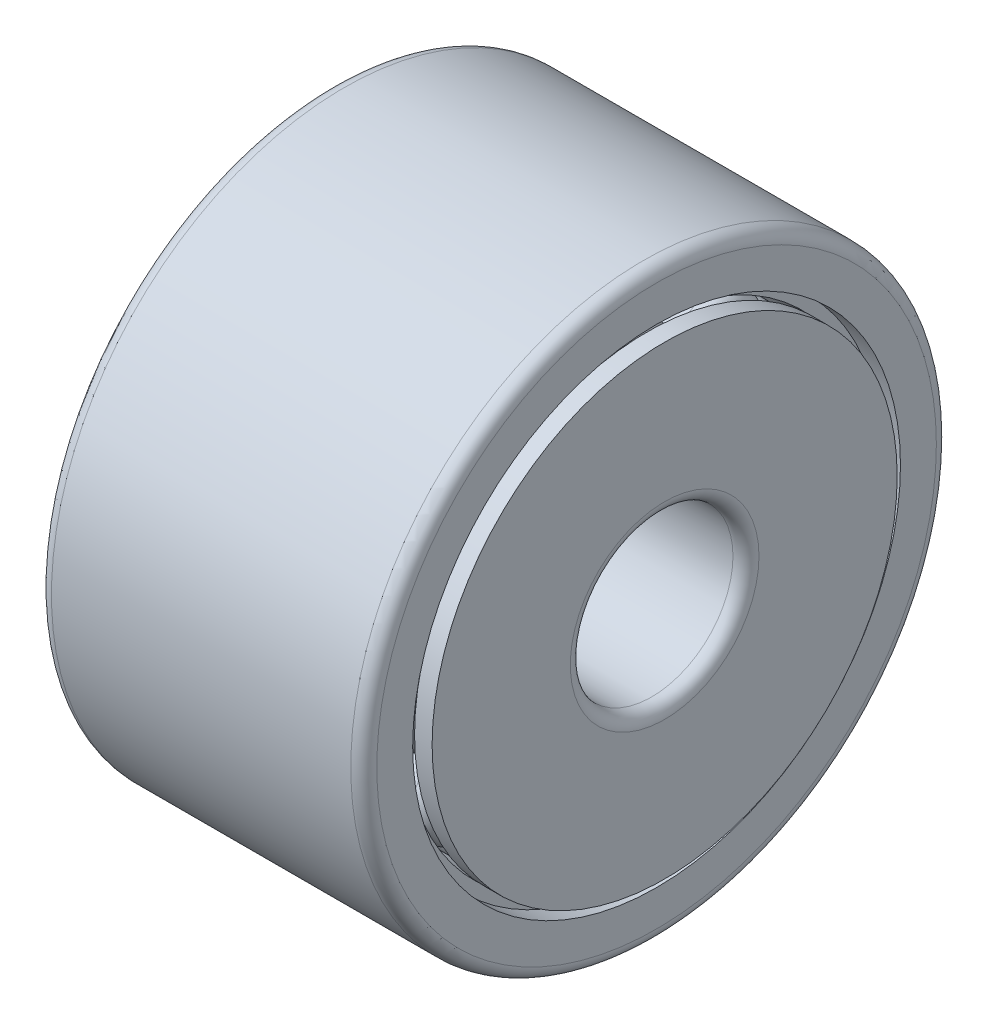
SolidWorks part; units mm, degrees
ref_plane "Plane1" through (0, 0, 0) normal (0, 0, 1) x (1, 0, 0)
ref_plane "Plane2" through (0, 0, 0) normal (0, 1, 0) x (1, 0, 0)
ref_plane "Plane3" through (0, 0, 0) normal (1, 0, 0) x (0, 0, -1)
sketch "Clipboard" plane through (0, 0, 0) normal (0, 0, 1) x (1, 0, 0)
  line L0 (-10, 0) -> (10, 0) construction
  line L1 (0, 0) -> (27.0344, -5.7463)
  line L2 (0, 0) -> (22.4793, 28.7722)
  line L3 (0, 0) -> (27.9428, -35.7651)
  line L4 (0, 0) -> (-22.3471, -0.7804)
  dimension "CLdia" = 36.5125
  dimension "Count" = 52
  dimension "Show_count" = 52
  dimension "Max_count" = 12
  dimension "Min_count" = 2
  dimension "Race_OD" = 45.3866
  dimension "Race_ID" = 27.6384
sketch "OutRacSke" plane through (0, 0, 0) normal (0, 0, 1) x (1, 0, 0)
  line L0 (-14.0229, 22.6933) -> (-14.0229, 23.8026)
  line L1 (-14.0229, 23.8026) -> (-15.875, 23.8026)
  line L2 (-15.875, 23.8026) -> (-15.875, 27.305)
  line L3 (-14.605, 28.575) -> (14.605, 28.575)
  line L4 (15.875, 27.305) -> (15.875, 23.8026)
  line L5 (15.875, 23.8026) -> (14.0229, 23.8026)
  line L6 (14.0229, 23.8026) -> (14.0229, 22.6933)
  line L7 (14.0229, 22.6933) -> (-14.0229, 22.6933)
  line L8 (-7.9375, 0) -> (7.9375, 0) construction
  arc A0 (-15.875, 27.305) -> (-14.605, 28.575) centre (-14.605, 27.305) cw
  arc A1 (14.605, 28.575) -> (15.875, 27.305) centre (14.605, 27.305) cw
  dimension "Radius" = 1.27
  dimension "D1" = 14.0229
  dimension "Race_OD" = 45.3866
  dimension "OD" = 57.15
  dimension "Cyl_Len" = 28.0458
  dimension "Width" = 31.75
  dimension "Groove_Dp" = 1.1093
  dimension "halfWidth" = 15.875
revolve "OuterRace" add sketch "OutRacSke" angle 360 about L8
sketch "RolDetSke" plane through (0, 0, 0) normal (0, 0, 1) x (1, 0, 0)
  line L0 (-14.0229, 20.9261) -> (-14.0229, 18.2562)
  line L1 (-14.0229, 18.2562) -> (14.0229, 18.2562)
  line L2 (14.0229, 18.2562) -> (14.0229, 20.9261)
  line L3 (12.243, 22.706) -> (-12.243, 22.706)
  line L4 (-28.575, 18.2562) -> (28.575, 18.2562) construction
  arc A0 (14.0229, 20.9261) -> (12.243, 22.706) centre (12.243, 20.9261) ccw
  arc A1 (-12.243, 22.706) -> (-14.0229, 20.9261) centre (-12.243, 20.9261) ccw
  dimension "radius" = 1.7799
  dimension "CLRad" = 18.2562
  dimension "Roller_diameter" = 8.8995
  dimension "Cyl_Len" = 28.0458
  dimension "halfCylLen" = 14.0229
revolve "RollerDetailed" add sketch "RolDetSke" angle 360 about L4
ref_axis "Axis1" through (-50, 0, 0) along (1, 0, 0)
pattern_circular "RollersDetailed" count 12 every 30 about axis through (-50, 0, 0) along (1, 0, 0) of "RollerDetailed"
sketch "RolSimSke" plane through (0, 25.4, 0) normal (0, 0, 1) x (1, 0, 0)
  line L0 (-14.0229, -4.4612) -> (-14.0229, -9.8009)
  line L1 (-25.4, -25.4) -> (25.4, -25.4) construction
  line L2 (14.0229, -9.8009) -> (14.0229, -4.4612)
  line L3 (12.243, -2.6813) -> (-12.243, -2.6813)
  line L5 (12.243, -11.5808) -> (-12.243, -11.5808)
  arc A0 (14.0229, -4.4612) -> (12.243, -2.6813) centre (12.243, -4.4612) ccw
  arc A1 (-12.243, -2.6813) -> (-14.0229, -4.4612) centre (-12.243, -4.4612) ccw
  arc A2 (14.0229, -9.8009) -> (12.243, -11.5808) centre (12.243, -9.8009) cw
  arc A3 (-12.243, -11.5808) -> (-14.0229, -9.8009) centre (-12.243, -9.8009) cw
  dimension "radius" = 1.7799
  dimension "Bore" = 27.6384
  dimension "Roller_diameter" = 8.8995
  dimension "Cyl_Len" = 28.0458
  dimension "halfLength" = 14.0229
revolve "RollersSimplified" [suppressed] add sketch "RolSimSke" angle 360 about L1
sketch "InsRacSke" plane through (0, 0, 0) normal (0, 0, 1) x (1, 0, 0)
  line L0 (-14.949, 13.8192) -> (-14.949, 22.6933)
  line L1 (-14.949, 22.6933) -> (-16.6624, 22.6933)
  line L2 (-16.6624, 22.6933) -> (-16.6624, 9.2075)
  line L3 (-15.3924, 7.9375) -> (-0.84, 7.9375)
  line L4 (0.84, 7.9375) -> (15.3924, 7.9375)
  line L5 (16.6624, 9.2075) -> (16.6624, 22.6933)
  line L6 (16.6624, 22.6933) -> (14.949, 22.6933)
  line L7 (14.949, 22.6933) -> (14.949, 13.8192)
  line L8 (14.949, 13.8192) -> (-14.949, 13.8192)
  line L9 (-7.9375, 0) -> (7.9375, 0) construction
  arc A0 (-16.6624, 9.2075) -> (-15.3924, 7.9375) centre (-15.3924, 9.2075) ccw
  arc A1 (-0.84, 7.9375) -> (0.84, 7.9375) centre (0, 6.985) cw
  arc A2 (15.3924, 7.9375) -> (16.6624, 9.2075) centre (15.3924, 9.2075) ccw
  dimension "radius" = 1.27
  dimension "Bore" = 15.875
  dimension "Width_IR" = 33.3248
  dimension "halfWidth" = 16.6624
  dimension "SlotWidth" = 29.8979
  dimension "Race_OD" = 45.3866
  dimension "Race_ID" = 27.6384
  dimension "offset" = 0.9525
  dimension "halfSlotWidth" = 14.949
revolve "InnerRace" add sketch "InsRacSke" angle 360 about L9
equation "\"halfWidth@OutRacSke\" =  \"Width@OutRacSke\" / 2"
equation "\"CLdia@Clipboard\" =  ( \"Race_OD@Clipboard\" + \"Race_ID@Clipboard\" )  / 2"
equation "\"CLRad@RolDetSke\" = ( \"Race_OD@Clipboard\" + \"Race_ID@Clipboard\" )  / 4"
equation "\"Roller_diameter@RolDetSke\" =  ( \"Race_OD@Clipboard\" -  \"Race_ID@Clipboard\" )  / 2 + .001"
equation "\"Roller_diameter@RolSimSke\" = ( \"Race_OD@Clipboard\" -  \"Race_ID@Clipboard\" )  / 2 + .001"
equation "\"radius@RolDetSke\" = \"Roller_diameter@RolDetSke\" / 5"
equation "\"radius@RolSimSke\" = \"Roller_diameter@RolSimSke\" / 5"
equation "\"Cyl_Len@OutRacSke\" = \"Cyl_Len@RolDetSke\""
equation "\"Cyl_Len@RolSimSke\" = \"Cyl_Len@RolDetSke\""
equation "\"halfCylLen@RolDetSke\" = \"Cyl_Len@RolDetSke\" / 2"
equation "\"offset@InsRacSke\" = \"radius@InsRacSke\" * 0.75"
equation "\"SlotWidth@InsRacSke\" =  ( \"Width@OutRacSke\" + \"Cyl_Len@RolDetSke\" )  / 2"
equation "\"halfSlotWidth@InsRacSke\" = \"SlotWidth@InsRacSke\" / 2"
equation "\"D1@OutRacSke\" = \"Cyl_Len@OutRacSke\" / 2"
equation "\"Max_count@Clipboard\" = int( 3.14159265 / atn(( \"Roller_diameter@RolDetSke\" / 2) / sqr( \"CLRad@RolDetSke\"  *  \"CLRad@RolDetSke\" - ( \"Roller_diameter@RolDetSke\" / 2) *  ( \"Roller_diameter@RolDetSke\" / "
equation "\"Max_count@Clipboard\" = ((sgn( \"Max_count@Clipboard\" - \"Count@Clipboard\" )-1)*( \"Max_count@Clipboard\" - \"Count@Clipboard\" ))/-2+ \"Count@Clipboard\""
equation "\"Count@RollersDetailed\" = int( \"Show_count@Clipboard\" ) "
equation "\"Count@RollersDetailed\" = ((sgn( \"Count@RollersDetailed\" - \"Max_count@Clipboard\" )-1)*( \"Count@RollersDetailed\" - \"Max_count@Clipboard\" ))/-2+ \"Max_count@Clipboard\""
equation "\"Count@RollersDetailed\" = ((sgn( \"Count@RollersDetailed\" - \"Min_count@Clipboard\" )+1)*( \"Count@RollersDetailed\" - \"Min_count@Clipboard\"))/2 +\"Min_count@Clipboard\""
equation "\"Angle@RollersDetailed\" = 360.0 / \"Max_count@Clipboard\""
equation "\"Bore@RolSimSke\" = \"Race_ID@Clipboard\""
equation "\"Race_ID@InsRacSke\" = \"Race_ID@Clipboard\""
equation "\"Race_OD@InsRacSke\" = \"Race_OD@Clipboard\""
equation "\"halfWidth@InsRacSke\" = \"Width_IR@InsRacSke\" / 2"
equation "\"halfLength@RolSimSke\" = \"Cyl_Len@RolSimSke\" / 2"
equation "\"Race_OD@OutRacSke\" = \"Race_OD@Clipboard\""
